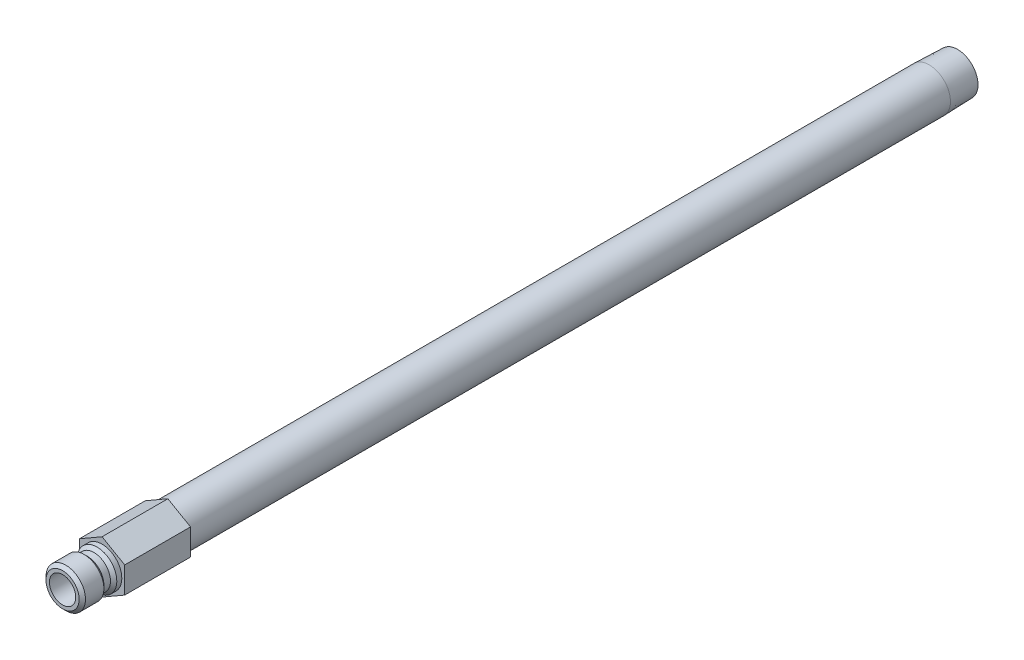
SolidWorks part; units mm, degrees
ref_plane "Front Plane" through (0, 0, 0) normal (0, 0, 1) x (1, 0, 0)
ref_plane "Top Plane" through (0, 0, 0) normal (0, 1, 0) x (1, 0, 0)
ref_plane "Right Plane" through (0, 0, 0) normal (1, 0, 0) x (0, 0, -1)
sketch "Sketch1" plane through (0, 0, 0) normal (1, 0, 0) x (0, 0, -1)
  line L0 (0, 0) -> (-12.7, 0) construction
  line L1 (-9.525, 3.175) -> (-9.525, 4.0005)
  line L2 (-3.556, 4.0005) -> (-3.556, 0) construction
  line L3 (-8.763, 4.7625) -> (-4.318, 4.7625)
  line L4 (0, 5.1435) -> (0, 3.4163) construction
  line L5 (-3.556, 4.0005) -> (-1.9685, 4.0005)
  line L6 (-1.2065, 4.7625) -> (0, 4.7625)
  line L7 (0, 4.7625) -> (0, 5.1435)
  line L8 (-3.556, 4.0005) -> (-4.318, 4.7625)
  line L9 (-1.9685, 4.0005) -> (-1.2065, 4.7625)
  line L10 (-9.525, 4.0005) -> (-8.763, 4.7625)
  line L12 (0, 5.1435) -> (199.517, 5.1435)
  line L13 (199.517, 5.1435) -> (206.375, 4.9292)
  line L14 (206.375, 4.9292) -> (206.375, 2.3813)
  line L15 (0, 0) -> (15.875, 0) construction
  line L16 (15.875, 0) -> (15.875, 4.7625) construction
  line L17 (15.875, 4.7625) -> (0, 4.7625) construction
  line L18 (0.127, 2.3813) -> (206.375, 2.3813)
  line L19 (0.127, 3.175) -> (-9.525, 3.175)
  line L20 (0, 3.175) -> (0, 0) construction
  line L21 (0.127, 2.3813) -> (0.127, 3.175)
  dimension "D1" = 9.525
  dimension "D2" = 1.5875
  dimension "D3" = 0.762
  dimension "D4" = 45
  dimension "D5" = 5.969
  dimension "D6" = 45
  dimension "D7" = 1.79
  dimension "D8" = 6.858
  dimension "D9" = 215.9
  dimension "D10" = 3.175
  dimension "D11" = 25.4
  dimension "D12" = 4.7625
  dimension "D13" = 6.35
  dimension "D14" = 9.525
  dimension "D15" = 10.287
  dimension "D16" = 9.652
revolve "Revolve1" add sketch "Sketch1" angle 360 about L0
sketch "Sketch2" plane through (0, 0, 0) normal (0, 0, 1) x (1, 0, 0)
  line L1 (-5.461, 3.1529) -> (-5.461, -3.1529)
  line L2 (-5.461, -3.1529) -> (0, -6.3058)
  line L3 (0, -6.3058) -> (5.461, -3.1529)
  line L4 (5.461, -3.1529) -> (5.461, 3.1529)
  line L5 (5.461, 3.1529) -> (0, 6.3058)
  line L6 (0, 6.3058) -> (-5.461, 3.1529)
  circle A0 centre (0, 0) radius 5.461 construction
  circle A1 centre (0, 0) radius 2.3812 construction
  circle A2 centre (0, 0) radius 2.3812
  dimension "D1" = 10.922
extrude "Boss-Extrude1" add sketch "Sketch2" against normal up to vertex (15.875 mm away) from vertex at 0
